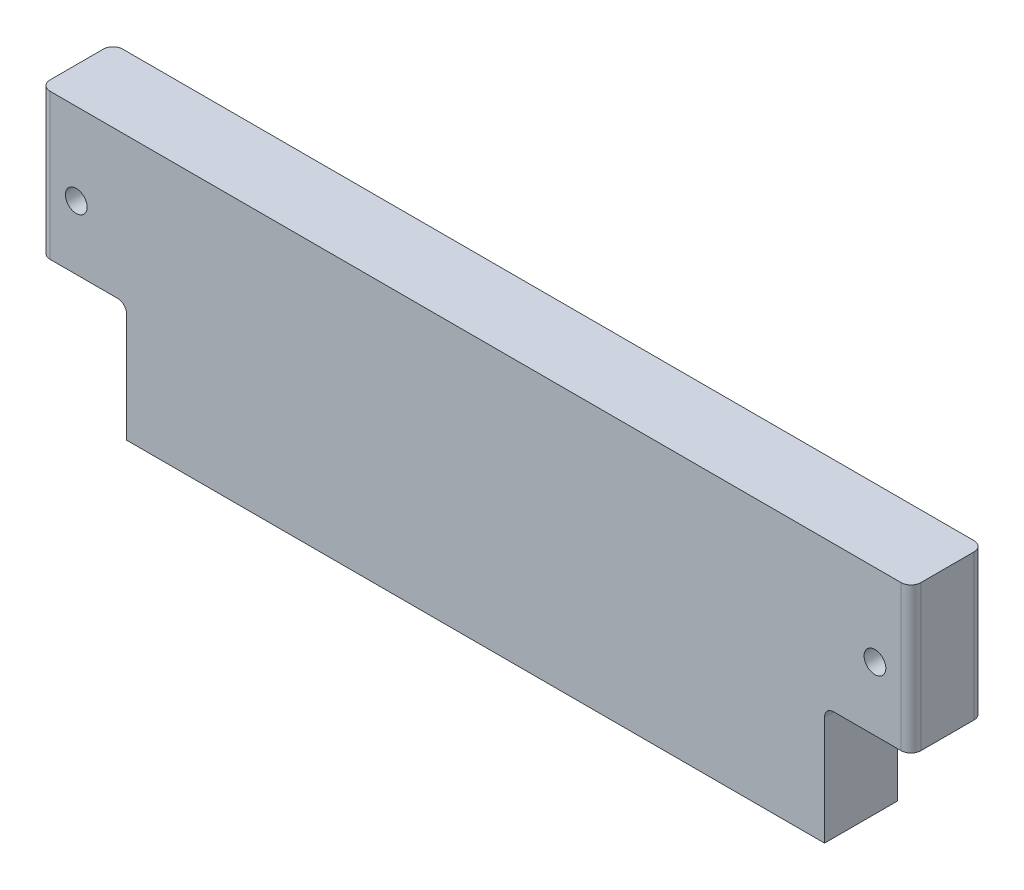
SolidWorks part; units mm, degrees
ref_plane "Front Plane" through (0, 0, 0) normal (0, 0, 1) x (1, 0, 0)
ref_plane "Top Plane" through (0, 0, 0) normal (0, 1, 0) x (1, 0, 0)
ref_plane "Right Plane" through (0, 0, 0) normal (1, 0, 0) x (0, 0, -1)
sketch "Sketch1" plane through (0, 0, 0) normal (0, 0, 1) x (1, 0, 0)
  line L1 (-75.946, 12.7) -> (75.946, 12.7)
  line L2 (-75.946, 12.7) -> (-75.946, -12.7)
  line L3 (-75.946, -12.7) -> (75.946, -12.7)
  line L4 (75.946, 12.7) -> (75.946, -12.7)
  line L5 (-75.946, 12.7) -> (75.946, -12.7) construction
  line L6 (-75.946, -12.7) -> (75.946, 12.7) construction
  line L7 (-76.073, -12.7) -> (-76.073, 12.7) construction
  point P0 (0, 0)
  dimension "D1" = 25.4
  dimension "D2" = 0.127
extrude "Boss-Extrude1" add sketch "Sketch1" along normal mid plane 12.7
hole_wizard "#10-24 Tapped Hole1" positions "Sketch4" profile "Sketch5" tap size "#10-24" standard "ANSI Inch"
sketch "Sketch4" plane through (0, 0, 6.35) normal (0, 0, 1) x (1, 0, 0)
  point P0 (-69.6595, -1.5875)
  point P10 (69.6595, -1.5875)
sketch "Sketch5" plane through (-69.6595, -1.5875, 6.35) normal (1, 0, 0) x (0, -1, 0)
  line L0 (0, 0) -> (0, 12.7)
  line L1 (0, 12.7) -> (1.8986, 12.7)
  line L2 (1.8986, 12.7) -> (1.8986, 0)
  line L5 (1.8986, 0) -> (0, 0)
  line L11 (0, -6.35) -> (0, 107.95) construction
  dimension "Thru Tap Drill Dia." = 3.7973
  dimension "Thru Tap Drill Depth" = 12.7
sketch "Sketch6" plane through (0, 0, 6.35) normal (0, 0, 1) x (1, 0, 0)
  line L0 (-75.946, -12.7) -> (75.946, -12.7) construction
  line L1 (-60.8711, -12.7) -> (60.8711, -12.7)
  line L2 (-60.8711, -12.7) -> (-60.8711, -33.3375)
  line L3 (-60.8711, -33.3375) -> (60.8711, -33.3375)
  line L4 (60.8711, -12.7) -> (60.8711, -33.3375)
  line L8 (-75.946, 12.7) -> (-75.946, -12.7) construction
  line L9 (0, -33.3375) -> (0, 12.7) construction
  line L10 (75.946, 12.7) -> (-75.946, 12.7) construction
  dimension "D1" = 15.0749
  dimension "D2" = 20.6375
extrude "Boss-Extrude2" add sketch "Sketch6" against normal up to surface (12.7 mm away)
fillet "Fillet1" radius 1.7145 4 edges at (-75.946, 0, -6.35) (-75.946, 0, 6.35) (75.946, 0, -6.35) (75.946, 0, 6.35)
fillet "Fillet2" radius 1.5875 2 edges at (-60.8711, -12.7, 0) (60.8711, -12.7, 0)
